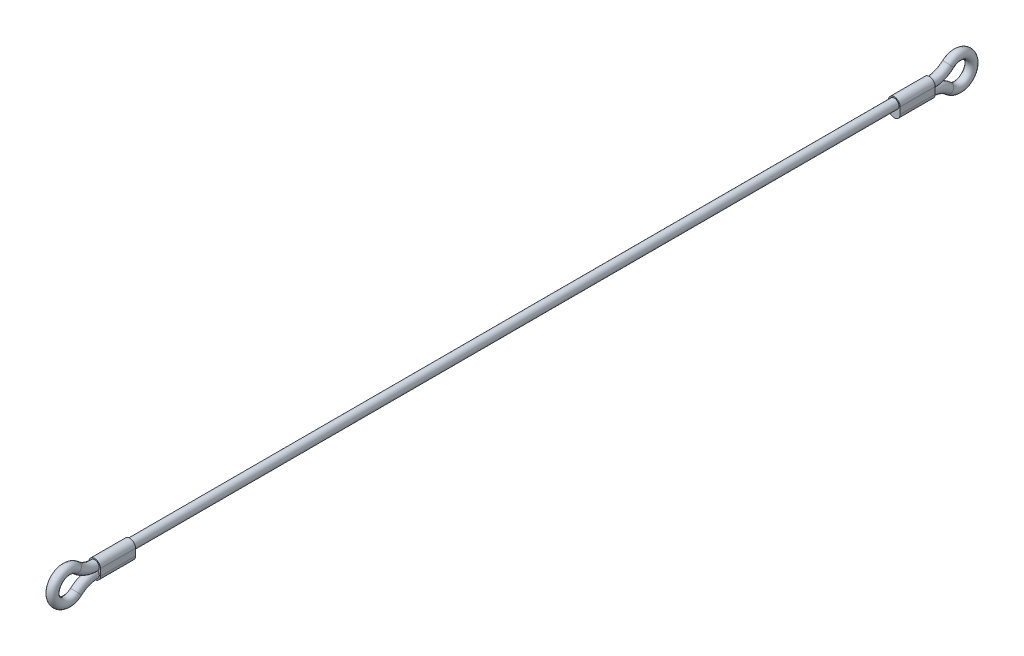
SolidWorks part; units mm, degrees
ref_plane "Front Plane" through (0, 0, 0) normal (0, 0, 1) x (1, 0, 0)
ref_plane "Top Plane" through (0, 0, 0) normal (0, 1, 0) x (1, 0, 0)
ref_plane "Right Plane" through (0, 0, 0) normal (1, 0, 0) x (0, 0, -1)
sketch "Sketch1" plane through (0, 0, 0) normal (1, 0, 0) x (0, 0, -1)
  line L0 (142.8, 0) -> (-142.8, 0)
  line L1 (0, 2.1945) -> (0, -2.1945) construction
  arc A0 (-142.8, 0) -> (-149.2, 2.4446) centre (-142.8, 9.6) cw
  arc A1 (-149.2, 2.4446) -> (-149.2, -4.7108) centre (-152.4, -1.1331) ccw
  arc A2 (-149.2, -4.7108) -> (-142.8, -2.2663) centre (-142.8, -11.8663) cw
  arc A3 (149.2, -4.7108) -> (142.8, -2.2663) centre (142.8, -11.8663) ccw
  arc A4 (149.2, 2.4446) -> (149.2, -4.7108) centre (152.4, -1.1331) cw
  arc A5 (142.8, 0) -> (149.2, 2.4446) centre (142.8, 9.6) ccw
  point P18 (0, 0)
  dimension "D1" = 4.8
  dimension "D4" = 9.6
  dimension "D2" = 152.4
  dimension "D3" = 9.6
sketch "Sketch2" plane through (0, 0, 0) normal (0, 0, 1) x (1, 0, 0)
  circle A0 centre (0, 0) radius 1.59
  dimension "D1" = 3.18
sweep "Sweep1" add profiles "Sketch2" path "Sketch1"
sketch "Sketch3" plane through (0, 0, 142.8) normal (0, 0, -1) x (-1, 0, 0)
  line L0 (0, 0) -> (0, -2.2663) construction
  line L1 (1.995, 0) -> (1.995, -2.2663)
  line L2 (-1.995, 0) -> (-1.995, -2.2663)
  line L3 (-1.59, -2.2663) -> (1.59, -2.2663) construction
  arc A0 (1.995, 0) -> (-1.995, 0) centre (0, 0) ccw
  arc A1 (-1.995, -2.2663) -> (1.995, -2.2663) centre (0, -2.2663) ccw
  point P3 (0, -1.1331)
  dimension "D1" = 3.99
extrude "Boss-Extrude1" add sketch "Sketch3" along normal blind 12
mirror "Mirror1" about plane through (0, 0, 0) normal (0, 0, 1) of "Boss-Extrude1"
